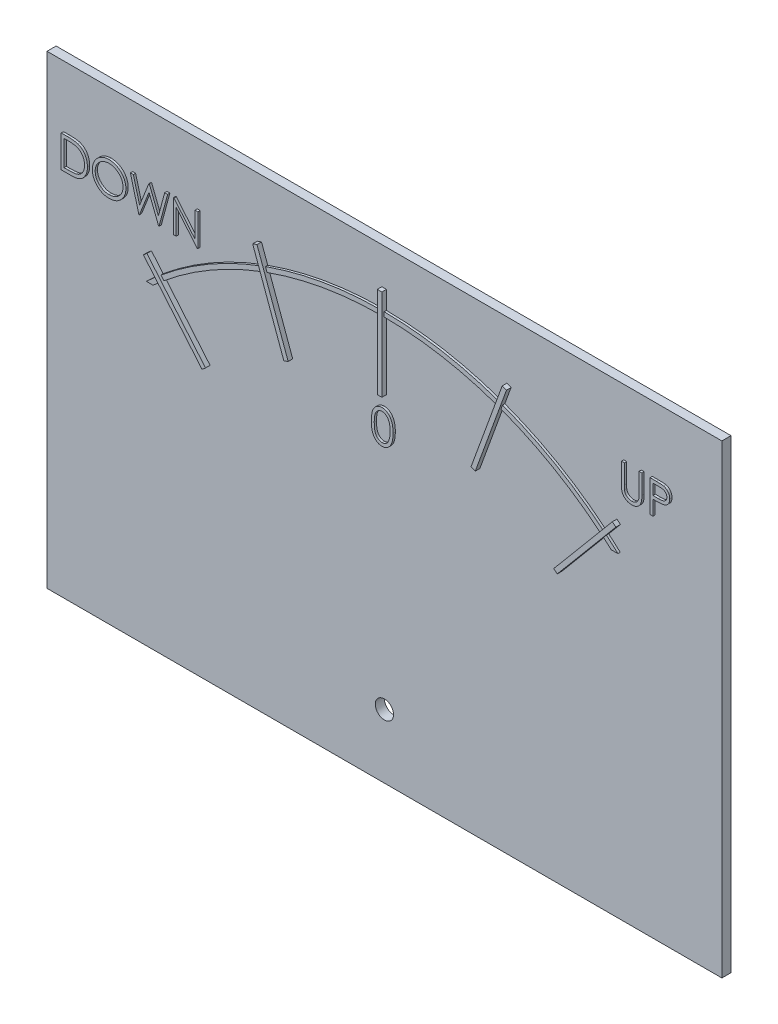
SolidWorks part; units mm, degrees
ref_plane "Plan de face" through (0, 0, 0) normal (0, 0, 1) x (1, 0, 0)
ref_plane "Plan de dessus" through (0, 0, 0) normal (0, 1, 0) x (1, 0, 0)
ref_plane "Plan de droite" through (0, 0, 0) normal (1, 0, 0) x (0, 0, -1)
sketch "Esquisse1" plane through (0, 0, 0) normal (0, 0, 1) x (1, 0, 0)
  line L1 (0, 0) -> (74, 0)
  line L2 (0, 0) -> (0, 51)
  line L3 (0, 51) -> (74, 51)
  line L4 (74, 0) -> (74, 51)
  dimension "D1" = 74
  dimension "D2" = 51
extrude "Boss.-Extru.1" add sketch "Esquisse1" along normal blind 1
sketch "Esquisse2" plane through (0, 0, 1) normal (0, 0, 1) x (1, 0, 0)
  line L0 (-3.9121, 7) -> (76.5089, 7) construction
  line L1 (37, -1.682) -> (37, 53.0449) construction
  line L2 (0, 51) -> (0, 0) construction
  line L3 (0, 0) -> (74, 0) construction
  circle A0 centre (37, 7) radius 1
  dimension "D3" = 2
  dimension "D1" = 37
  dimension "D2" = 7
extrude "Enlèv. mat.-Extru.1" cut sketch "Esquisse2" against normal through all
sketch "Esquisse3" plane through (0, 0, 1) normal (0, 0, 1) x (1, 0, 0)
  line L0 (-2.6994, 34.8484) -> (77.5602, 34.8484) construction
  line L1 (11.1452, 34.8484) -> (11.8859, 34.8484)
  line L2 (62.1141, 34.8484) -> (62.8548, 34.8484)
  line L3 (74, 0) -> (74, 51) construction
  arc A0 (11.1452, 34.8484) -> (62.8548, 34.8484) centre (37, 7) cw
  arc A1 (11.8859, 34.8484) -> (62.1141, 34.8484) centre (37, 7) cw
  dimension "D1" = 0.5
  dimension "D2" = 38
  dimension "D3" = 11.8859
extrude "Boss.-Extru.2" add sketch "Esquisse3" along normal blind 0.25
sketch "Esquisse6" plane through (0, 0, 1) normal (0, 0, 1) x (1, 0, 0)
  text T0 "DOWN"
extrude "Boss.-Extru.4" add sketch "Esquisse6" along normal blind 0.25
sketch "Esquisse7" plane through (0, 0, 1) normal (0, 0, 1) x (1, 0, 0)
  text T0 "UP"
extrude "Boss.-Extru.5" add sketch "Esquisse7" along normal blind 0.25
sketch "Esquisse8" plane through (0, 0, 1) normal (0, 0, 1) x (1, 0, 0)
  line L0 (37, 8.5168) -> (37, 51.8637) construction
  line L1 (37, 7) -> (10.2658, 38.8606) construction
  line L2 (37, 7) -> (63.7011, 38.8211) construction
  line L3 (37, 7) -> (23.2048, 44.9019) construction
  line L4 (37, 7) -> (51.4969, 46.8298) construction
  line L5 (0, 51) -> (0, 0) construction
  line L6 (11.071, 37.458) -> (17.4989, 29.7975)
  line L7 (17.4989, 29.7975) -> (17.8819, 30.1189)
  line L8 (17.8819, 30.1189) -> (11.454, 37.7794)
  line L9 (11.454, 37.7794) -> (11.071, 37.458)
  line L10 (23.052, 44.4894) -> (26.4722, 35.0924)
  line L11 (26.4722, 35.0924) -> (26.942, 35.2634)
  line L12 (26.942, 35.2634) -> (23.5218, 44.6604)
  line L13 (23.5218, 44.6604) -> (23.052, 44.4894)
  line L14 (36.7153, 46.999) -> (36.7153, 36.999)
  line L15 (36.7153, 36.999) -> (37.2153, 36.999)
  line L16 (37.2153, 36.999) -> (37.2153, 46.999)
  line L17 (37.2153, 46.999) -> (36.7153, 46.999)
  line L18 (50.4129, 44.6841) -> (46.9927, 35.2872)
  line L19 (46.9927, 35.2872) -> (47.4625, 35.1162)
  line L20 (47.4625, 35.1162) -> (50.8827, 44.5131)
  line L21 (50.8827, 44.5131) -> (50.4129, 44.6841)
  line L22 (62.4927, 37.824) -> (56.0648, 30.1636)
  line L23 (56.0648, 30.1636) -> (56.4479, 29.8422)
  line L24 (56.4479, 29.8422) -> (62.8757, 37.5026)
  line L25 (62.8757, 37.5026) -> (62.4927, 37.824)
  line L26 (37, 7) -> (17.8819, 30.1189) construction
  line L27 (37, 7) -> (26.942, 35.2634) construction
  arc A0 (62.8548, 34.8484) -> (11.1452, 34.8484) centre (37, 7) ccw construction
  dimension "D8" = 40
  dimension "D1" = 20
  dimension "D2" = 20
  dimension "D3" = 20
  dimension "D4" = 20
  dimension "D5" = 37
  dimension "D6" = 0.5
  dimension "D7" = 10
  dimension "D9" = 0.2847
  dimension "D10" = 0.2847
  dimension "D12" = 20
  dimension "D11" = 5
extrude "Boss.-Extru.7" add sketch "Esquisse8" along normal blind 0.5
sketch "Esquisse10" plane through (0, 0, 1) normal (0, 0, 1) x (1, 0, 0)
  text T0 "0"
extrude "Boss.-Extru.8" add sketch "Esquisse10" along normal blind 0.25
